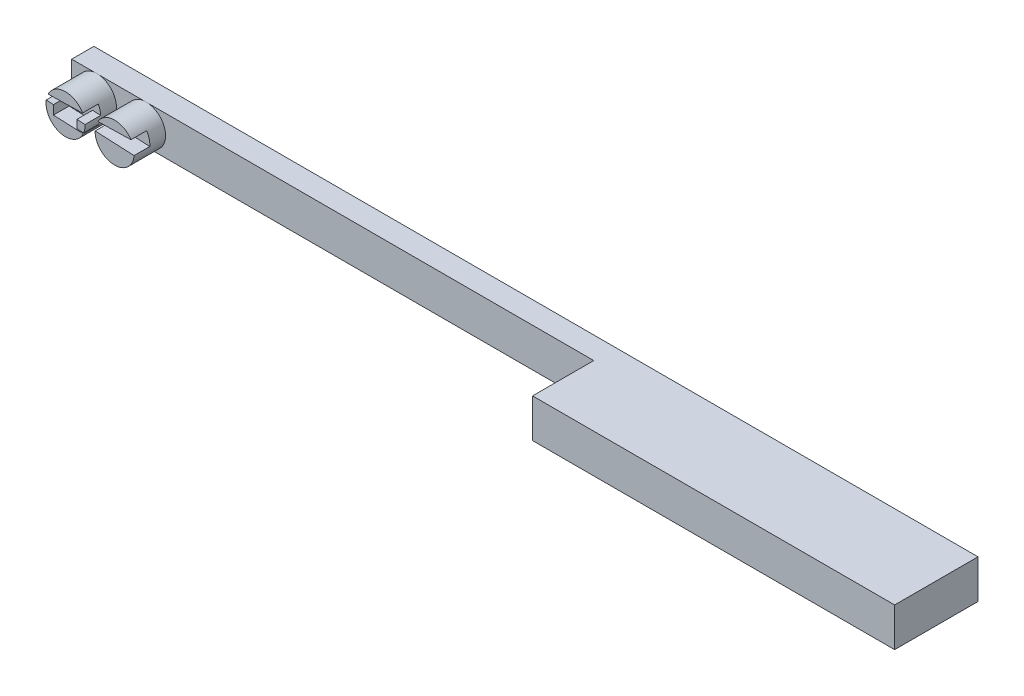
SolidWorks part; units mm, degrees
ref_plane "Front Plane" through (0, 0, 0) normal (0, 0, 1) x (1, 0, 0)
ref_plane "Top Plane" through (0, 0, 0) normal (0, 1, 0) x (1, 0, 0)
ref_plane "Right Plane" through (0, 0, 0) normal (1, 0, 0) x (0, 0, -1)
ref_plane "Plane1" through (-24.638, 0, 0) normal (1, 0, 0) x (0, 0, -1)
ref_plane "Plane2" through (0, 0, -1.0033) normal (0, 0, 1) x (1, 0, 0)
ref_plane "Plane3" through (0, -1.7526, 0) normal (0, 1, 0) x (-1, 0, 0)
sketch "Sketch1" plane through (0, -1.7526, 0) normal (0, 1, 0) x (-1, 0, 0)
  line L0 (55.372, -1.0033) -> (55.372, 1.0033)
  line L1 (55.372, 1.0033) -> (8.128, 1.0033)
  line L2 (8.128, 1.0033) -> (8.128, 6.5405)
  line L3 (8.128, 6.5405) -> (-24.638, 6.5405)
  line L4 (-24.638, 6.5405) -> (-24.638, -1.0033)
  line L5 (-24.638, -1.0033) -> (55.372, -1.0033)
  dimension "D1" = 80.01
  dimension "D2" = 32.766
extrude "Extrude1" add sketch "Sketch1" along normal blind 3.5052
ref_plane "Plane4" through (0, 0, 1.0033) normal (0, 0, 1) x (1, 0, 0)
sketch "Sketch2" plane through (0, 0, 1.0033) normal (0, 0, 1) x (1, 0, 0)
  line L0 (-55.372, 1.7526) -> (-55.372, -1.7526) construction
  circle A0 centre (-53.086, 0) radius 1.7653
  point P2 (0, 0)
  dimension "D1" = 2.286
extrude "Extrude2" add sketch "Sketch2" along normal blind 2.8448
ref_plane "Plane5" through (0, 0, 3.8481) normal (0, 0, 1) x (1, 0, 0)
sketch "Sketch3" plane through (0, 0, 3.8481) normal (0, 0, 1) x (1, 0, 0)
  line L0 (-54.1782, 0.6115) -> (-54.1782, -0.6115)
  line L1 (-54.1782, -0.6115) -> (-40.419, -1.223)
  line L2 (-40.419, -1.223) -> (-52.0598, -0.6115)
  line L3 (-52.0598, -0.6115) -> (-52.0598, 0.6115)
  line L4 (-52.0598, 0.6115) -> (-40.419, 1.223)
  line L5 (-40.419, 1.223) -> (-54.1782, 0.6115)
  line L6 (-55.372, 1.7526) -> (-55.372, -1.7526) construction
  dimension "D1" = 1.1938
  dimension "D2" = 2.1184
extrude "Cut-Extrude1" cut sketch "Sketch3" against normal blind 1.4224
sketch "Sketch4" plane through (0, 0, 1.0033) normal (0, 0, 1) x (1, 0, 0)
  circle A0 centre (-48.641, 0) radius 1.7653
  circle A1 centre (-53.086, 0) radius 1.7653 construction
  dimension "D1" = 4.445
sketch "Sketch5" plane through (0, 0, 3.8481) normal (0, 0, 1) x (1, 0, 0)
  line L0 (-62.4332, 0.6115) -> (-37.0332, -0.6115)
  line L1 (-37.0332, -0.6115) -> (-35.974, -1.223)
  line L2 (-35.974, -1.223) -> (-34.9148, -0.6115)
  line L3 (-34.9148, -0.6115) -> (-34.9148, 0.6115)
  line L4 (-34.9148, 0.6115) -> (-35.974, 1.223)
  line L5 (-35.974, 1.223) -> (-62.4332, 0.6115)
  line L6 (-54.1782, 0.6115) -> (-54.1782, -0.6115) construction
  point P6 (-49.7332, 0)
  dimension "D1" = 4.445
extrude "Extrude3" add sketch "Sketch4" along normal blind 2.8448
extrude "Cut-Extrude2" cut sketch "Sketch5" against normal blind 1.4224
